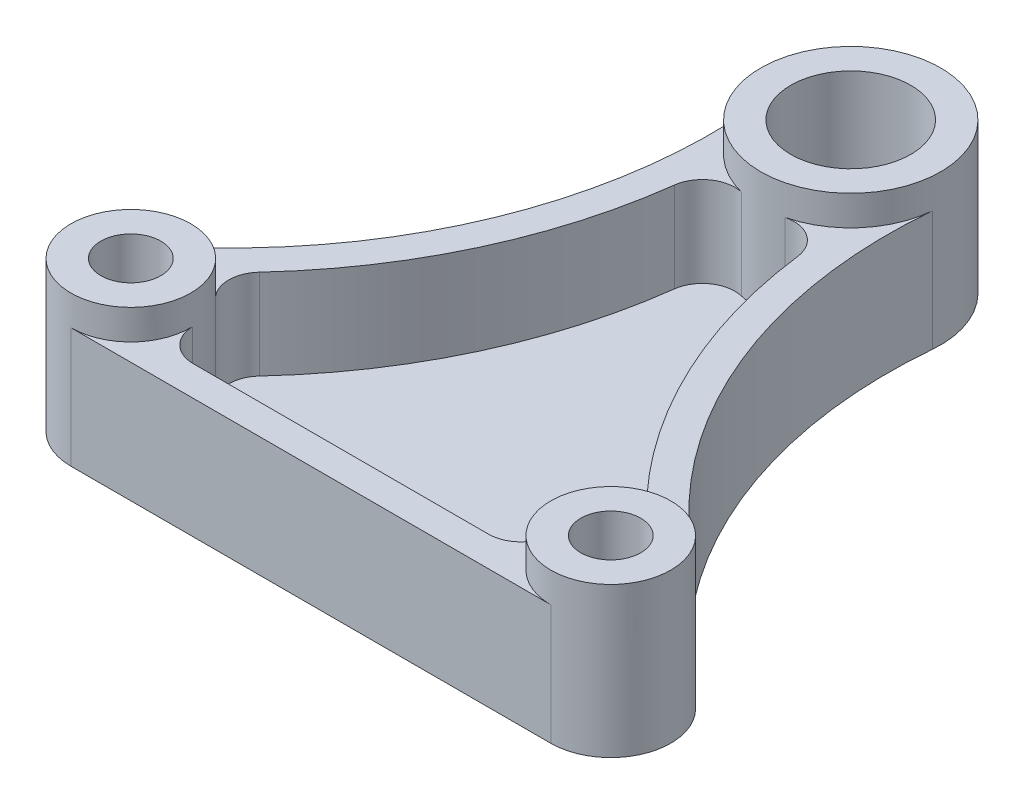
SolidWorks part; units mm, degrees
ref_plane "Front Plane" through (0, 0, 0) normal (0, 0, 1) x (1, 0, 0)
ref_plane "Top Plane" through (0, 0, 0) normal (0, 1, 0) x (1, 0, 0)
ref_plane "Right Plane" through (0, 0, 0) normal (1, 0, 0) x (0, 0, -1)
sketch "Outside Cirlces" plane through (0, 0, 0) normal (0, 1, 0) x (1, 0, 0)
  line L0 (0, 0) -> (0, -50.8) construction
  line L1 (0, -50.8) -> (25.4, -50.8) construction
  circle A0 centre (0, 0) radius 9.525
  circle A1 centre (25.4, -50.8) radius 6.35
  circle A2 centre (-25.4, -50.8) radius 6.35
  dimension "D1" = 19.05
  dimension "D2" = 12.7
  dimension "D3" = 50.8
  dimension "D4" = 25.4
sketch "Thru Holes" plane through (0, 0, 0) normal (0, 1, 0) x (1, 0, 0)
  circle A0 centre (0, 0) radius 6.35
  circle A1 centre (25.4, -50.8) radius 3.175
  circle A2 centre (-25.4, -50.8) radius 3.175
  dimension "D1" = 12.7
  dimension "D2" = 6.35
sketch "Profile" plane through (0, 0, 0) normal (0, 1, 0) x (1, 0, 0)
  line L0 (-25.4, -57.15) -> (25.4, -57.15)
  line L2 (0, 0) -> (0, -50.8) construction
  arc A0 (9.4871, -0.8493) -> (29.2539, -45.7532) centre (60.0847, -5.3787) ccw
  circle A1 centre (-25.4, -50.8) radius 6.35
  arc A2 (-29.2539, -45.7532) -> (-25.4, -57.15) centre (-25.4, -50.8) ccw
  circle A3 centre (25.4, -50.8) radius 6.35
  arc A4 (25.4, -57.15) -> (29.2539, -45.7532) centre (25.4, -50.8) ccw
  circle A5 centre (0, 0) radius 9.525
  arc A6 (9.4871, -0.8493) -> (-9.4871, -0.8493) centre (0, 0) ccw
  arc A7 (-9.4871, -0.8493) -> (-29.2539, -45.7532) centre (-60.0847, -5.3787) cw
  dimension "D4" = 50.8
  dimension "D1" = 0
  dimension "D2" = 0
  dimension "D3" = 0
sketch "Sketch1" plane through (0, 0, 0) normal (0, 1, 0) x (1, 0, 0)
  line L1 (-25.4, -57.15) -> (25.4, -57.15)
  line L2 (-25.4, -57.15) -> (25.4, -57.15)
  arc A5 (-29.2539, -45.7532) -> (-25.4, -57.15) centre (-25.4, -50.8) ccw
  arc A6 (25.4, -57.15) -> (29.2539, -45.7532) centre (25.4, -50.8) ccw
  arc A7 (9.4871, -0.8493) -> (29.2539, -45.7532) centre (60.0847, -5.3787) ccw
  arc A8 (9.4871, -0.8493) -> (-9.4871, -0.8493) centre (0, 0) ccw
  arc A9 (-29.2539, -45.7532) -> (-9.4871, -0.8493) centre (-60.0847, -5.3787) ccw
  arc A10 (-29.2539, -45.7532) -> (-25.4, -57.15) centre (-25.4, -50.8) ccw
  arc A11 (25.4, -57.15) -> (29.2539, -45.7532) centre (25.4, -50.8) ccw
  arc A12 (9.4871, -0.8493) -> (29.2539, -45.7532) centre (60.0847, -5.3787) ccw
  arc A13 (9.4871, -0.8493) -> (-9.4871, -0.8493) centre (0, 0) ccw
  arc A14 (-29.2539, -45.7532) -> (-9.4871, -0.8493) centre (-60.0847, -5.3787) ccw
  dimension "D1" = 0
extrude "Boss-Extrude1" add sketch "Sketch1" along normal blind 12.7
extrude "Boss-Extrude2" add sketch "Outside Cirlces" along normal blind 15.875 contours A1 | A2 | A0
sketch "Sketch2" plane through (0, 0, 0) normal (0, 1, 0) x (1, 0, 0)
  circle A0 centre (0, 0) radius 6.35 construction
  circle A1 centre (-25.4, -50.8) radius 3.175 construction
  circle A2 centre (25.4, -50.8) radius 3.175 construction
  circle A3 centre (0, 0) radius 6.35
  circle A4 centre (-25.4, -50.8) radius 3.175
  circle A5 centre (25.4, -50.8) radius 3.175
extrude "Cut-Extrude2" cut sketch "Sketch2" along normal through all
shell "Shell1" thickness 3.175
fillet "Fillet1" radius 3.429 6 edges at (19.9007, 7.9375, 53.975) (-19.9007, 7.9375, 53.975) (-23.2452, 7.9375, 44.8268) (-6.1432, 7.9375, 7.2792) (6.1432, 7.9375, 7.2792) (23.2452, 7.9375, 44.8268)
